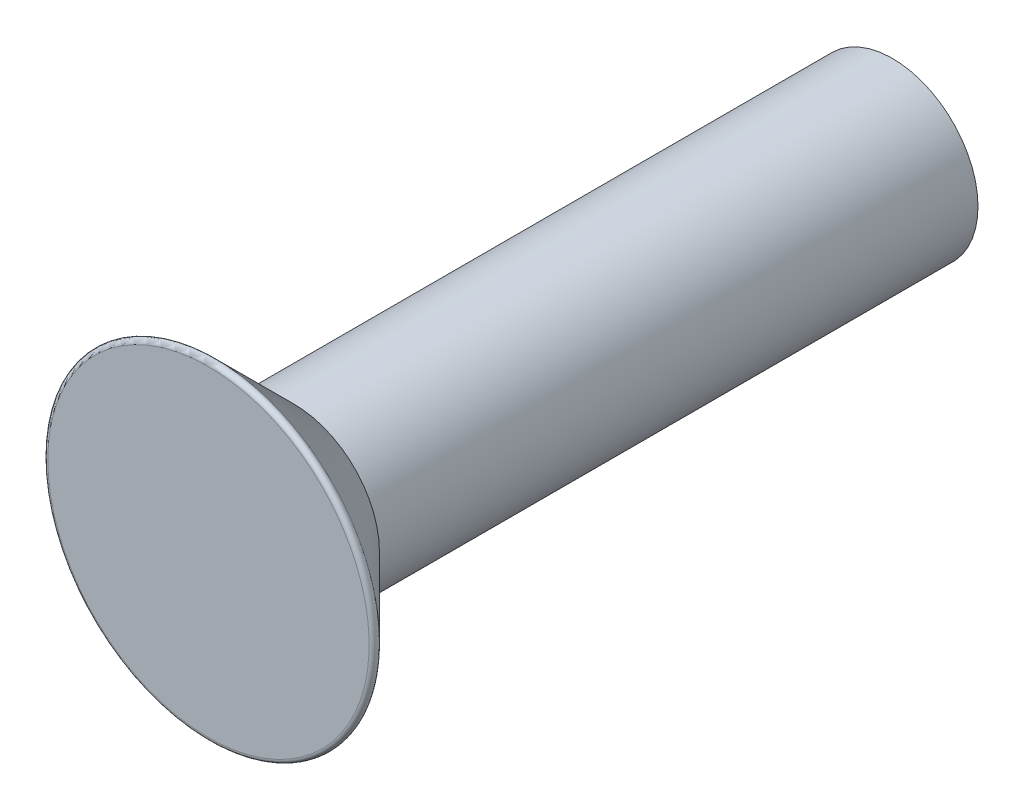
SolidWorks part; units mm, degrees
ref_plane "Front Plane" through (0, 0, 0) normal (0, 0, 1) x (1, 0, 0)
ref_plane "Top Plane" through (0, 0, 0) normal (0, 1, 0) x (1, 0, 0)
ref_plane "Right Plane" through (0, 0, 0) normal (1, 0, 0) x (0, 0, -1)
sketch "BaseBodySke" plane through (0, 0, 0) normal (0, 1, 0) x (1, 0, 0)
  line L0 (0, 0) -> (-6.35, 0)
  line L1 (0, 0) -> (0, 32.7778) construction
  line L2 (0, 0) -> (0, 25.4)
  line L3 (0, 25.4) -> (-3.175, 25.4)
  line L4 (-3.175, 3.175) -> (-3.175, 25.4)
  line L5 (-6.35, 25.4) -> (-6.35, 0) construction
  line L6 (-6.35, -3.175) -> (-6.35, 0) construction
  line L7 (-6.35, 0) -> (-3.175, 3.175)
  line L9 (-3.175, 3.175) -> (-3.175, 0) construction
  dimension "Diameter" = 6.35
  dimension "Head_Diameter" = 12.7
  dimension "Length" = 25.4
  dimension "Head_Depth" = 3.175
revolve "BaseBody" add sketch "BaseBodySke" angle 360 about L1
fillet "Fillet" radius 0.1588 1 edges at (6.35, 0, 0)
equation "\"D1@Fillet\" = \"Diameter@BaseBodySke\" / 40"
